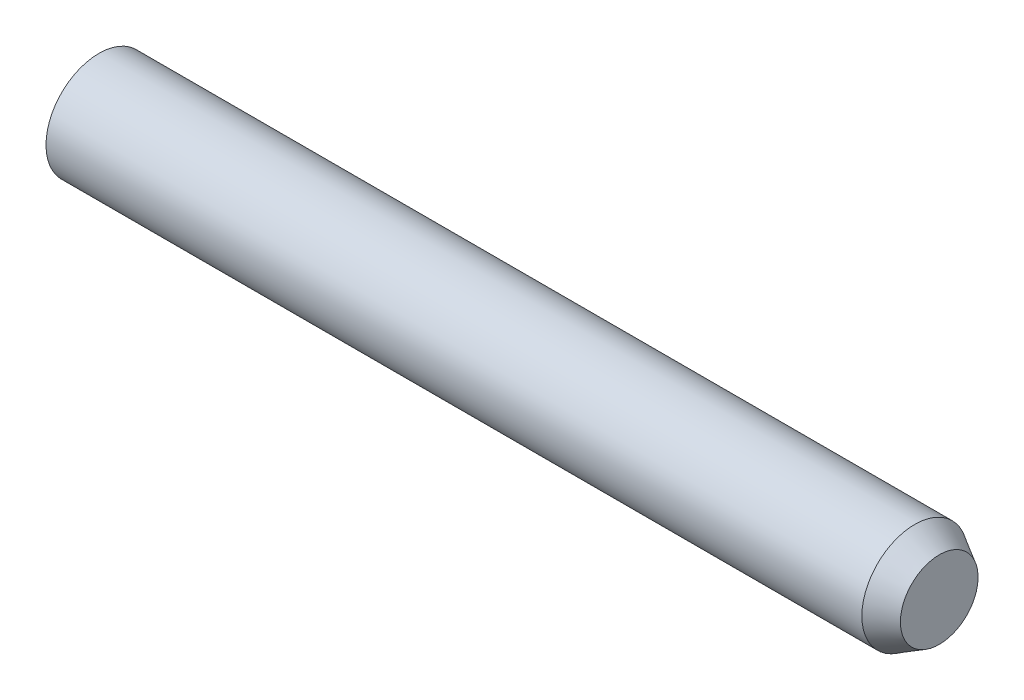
SolidWorks part; units mm, degrees
ref_plane "Face" through (0, 0, 0) normal (0, 0, 1) x (1, 0, 0)
ref_plane "Dessus" through (0, 0, 0) normal (0, 1, 0) x (1, 0, 0)
ref_plane "Droite" through (0, 0, 0) normal (1, 0, 0) x (0, 0, -1)
sketch "Esquisse1" plane through (0, 0, 0) normal (0, 0, 1) x (1, 0, 0)
  line L0 (-46.9437, 0) -> (51.4684, 0) construction
  line L1 (-11.8095, 1.5) -> (12, 1.5)
  line L2 (0, 1.5) -> (0, 0) construction
  line L3 (12, 1.5) -> (12, 0)
  line L5 (12, 0) -> (-12, 0)
  arc A0 (-11.8095, 1.5) -> (-12, 0) centre (-6, 0) ccw
  dimension "D3" = 6
  dimension "D1" = 24
  dimension "D2" = 3
  dimension "D4" = 12
revolve "Base-Révolution" add sketch "Esquisse1" angle 360 about L0
chamfer "Chanfrein1" distance 0.4 angle 60
